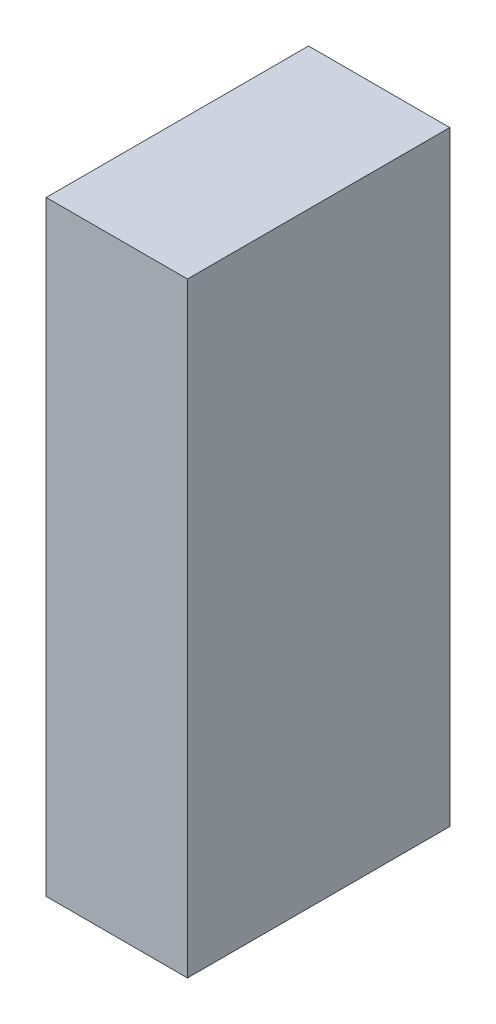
SolidWorks part; units mm, degrees
ref_plane "Plan de face" through (0, 0, 0) normal (0, 0, 1) x (1, 0, 0)
ref_plane "Plan de dessus" through (0, 0, 0) normal (0, 1, 0) x (1, 0, 0)
ref_plane "Plan de droite" through (0, 0, 0) normal (1, 0, 0) x (0, 0, -1)
sketch "Esquisse1" plane through (0, 0, 0) normal (0, 0, 1) x (1, 0, 0)
  line L1 (0, 0) -> (35, 0)
  line L2 (0, 0) -> (0, 150)
  line L3 (0, 150) -> (35, 150)
  line L4 (35, 0) -> (35, 150)
  dimension "D1" = 150
  dimension "D2" = 35
extrude "Extrusion1" add sketch "Esquisse1" along normal blind 65
